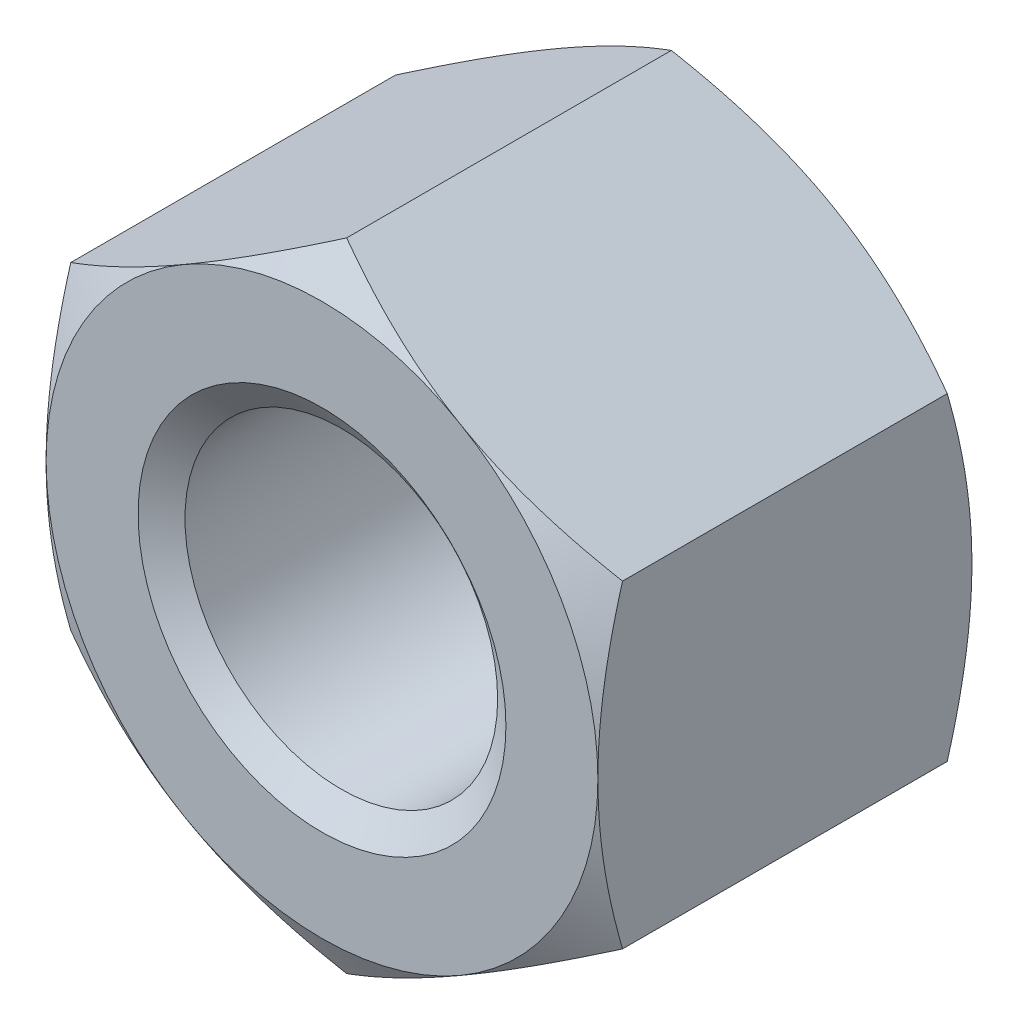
SolidWorks part; units mm, degrees
ref_plane "Plane1" through (0, 0, 0) normal (0, 0, 1) x (1, 0, 0)
ref_plane "Plane2" through (0, 0, 0) normal (0, 1, 0) x (1, 0, 0)
ref_plane "Plane3" through (0, 0, 0) normal (1, 0, 0) x (0, 0, -1)
revolve "EndChamfer" cut sketch "Sketch5"
sketch "Sketch5"
  line L0 (12.1746, 6) -> (11.4814, 5.01)
  line L1 (12.2254, 6) -> (12.1746, 6)
  line L2 (12.2254, 6) -> (12.2254, 5.01)
  line L3 (12.2254, 5.01) -> (11.4814, 5.01)
  line L6 (-0.0508, 6) -> (0, 6)
  line L7 (0, 6) -> (0.6932, 5.01)
  line L9 (0.6932, 5.01) -> (-0.0508, 5.01)
  line L10 (-0.0508, 5.01) -> (-0.0508, 6)
  line L11 (25.0375, 0) -> (38.388, 0) construction
  line L12 (12.2, 0) -> (0, 0) construction
extrude "BaseNut" add sketch "BaseNutSke" against normal blind 12.2
sketch "BaseNutSke" plane through (0, 0, 0) normal (0, 0, 1) x (1, 0, 0)
  line L6 (9, 5.1962) -> (9, -5.1962)
  line L7 (-9, 5.1962) -> (-9, -5.1962)
  line L8 (9, 5.1962) -> (0, 10.3923)
  line L9 (0, 10.3923) -> (-9, 5.1962)
  line L10 (-9, -5.1962) -> (0, -10.3923)
  line L11 (0, -10.3923) -> (9, -5.1962)
  circle A0 centre (0, 0) radius 5.1
  dimension "D4" = 9
  dimension "Tap_drill" = 10.2
  dimension "D1" = 120
  dimension "D2" = 9
  dimension "D3" = 9
  dimension "Width_flats" = 18
pattern_linear "ThdSchPat" [suppressed]
revolve "ThreadSchematic" cut sketch "ThdSchSke" angle 360 about L11
sketch "ThdSchSke" plane through (0, 0, 0) normal (0, 1, 0) x (1, 0, 0)
  line L0 (-6, 0.0254) -> (-5.1, 0.6556)
  line L1 (-5.1, 0.6556) -> (-2.55, 0.6556)
  line L2 (-2.55, 0.6556) -> (-2.55, -0.6048)
  line L3 (-2.55, -0.6048) -> (-5.1, -0.6048)
  line L4 (-5.1, -0.6048) -> (-6, 0.0254)
  line L5 (-3.175, 1.75) -> (3.175, 1.75) construction
  line L6 (0, 1.75) -> (0, -2.9874) construction
  line L7 (0, 11.5444) -> (0, 0.6302) construction
  dimension "D1" = 35
  dimension "VeeAngle" = 70
  dimension "SideAngle" = 55
  dimension "D2" = 0.0508
  dimension "OverCut" = 5.1
  dimension "Tap_Drill" = 10.2
  dimension "Advance" = 1.7356
  dimension "Thread_major" = 12
  dimension "Num_threads" = 8
  dimension "D4" = 50
  dimension "Offset1" = 12.2254
  dimension "ThreadMajor" = 6
  dimension "ChamferDepth" = 0.99
  dimension "Offset2" = 12.2762
sketch "Sketch3" plane through (0, 0, 0) normal (1, 0, 0) x (0, 0, -1)
  line L0 (12.2, 9) -> (11.3962, 10.3923)
  line L1 (11.3962, 10.3923) -> (11.3962, 20.3923)
  line L2 (11.3962, 20.3923) -> (22.2, 20.3923)
  line L3 (22.2, 20.3923) -> (22.2, 9)
  line L4 (22.2, 9) -> (12.2, 9)
  line L5 (12.2, 5.1962) -> (12.2, 10.3923) construction
  line L6 (12.2, 10.3923) -> (0, 10.3923) construction
  line L7 (0, 0) -> (38.6776, 0) construction
  line L8 (12.2, 0) -> (0, 0) construction
  line L9 (6.1, 10.3923) -> (6.1, 44.222) construction
  line L10 (0.8038, 20.3923) -> (-10, 20.3923)
  line L11 (-10, 20.3923) -> (-10, 9)
  line L12 (-10, 9) -> (0, 9)
  line L13 (0, 9) -> (0.8038, 10.3923)
  line L14 (0.8038, 10.3923) -> (0.8038, 20.3923)
  line L16 (12.2, 10.3923) -> (0, 10.3923) construction
  dimension "D1" = 9
  dimension "D2" = 30
  dimension "D3" = 10
  dimension "D4" = 10
revolve "Double-Chamfer" cut sketch "Sketch3" angle 360 about L7
equation "\"D2@BaseNutSke\" = \"Width_flats@BaseNutSke\" / 2"
equation "\"D3@BaseNutSke\" = \"Width_flats@BaseNutSke\" / 2"
equation "\"D1@Sketch3\" = \"Width_flats@BaseNutSke\" /2"
equation "\"D4@BaseNutSke\" = \"D3@BaseNutSke\""
equation "\"Thread_major@ThdSchSke\" = \"Thread_major@ThreadCosmetic\""
equation "\"Tap_drill@ThdSchSke\" = \"Tap_drill@BaseNutSke\""
equation "\"Overcut@ThdSchSke\" = \"Tap_drill@ThdSchSke\" * 0.5"
equation "\"Num_threads@ThdSchPat\" = int(  ( \"Thickness@BaseNut\" - 0.0508 ) / \"Advance@ThdSchSke\" + 0.999 )  + 1"
equation "\"Advance@ThdSchPat\" = ( \"Thickness@BaseNut\" - 0.0508 ) /  (\"Num_threads@ThdSchPat\" - 1) 'relax it"
equation "' \"Num_threads@ThdSchPat\" = \"Num_threads@ThdSchPat\" - sgn( \"Num_threads@ThdSchPat\" - 1) '---chamfered tips only---"
equation "\"ThreadMajor@Sketch5\" = \"Thread_major@ThreadCosmetic\" * 0.5"
equation "\"ChamferDepth@Sketch5\" = (\"Thread_major@ThreadCosmetic\" - \"Tap_drill@BaseNutSke\") * 0.55"
equation "\"Offset1@Sketch5\" = \"Thickness@BaseNut\" + 0.0254"
equation "\"Offset2@Sketch5\" = \"Offset1@Sketch5\" + 0.0508"
